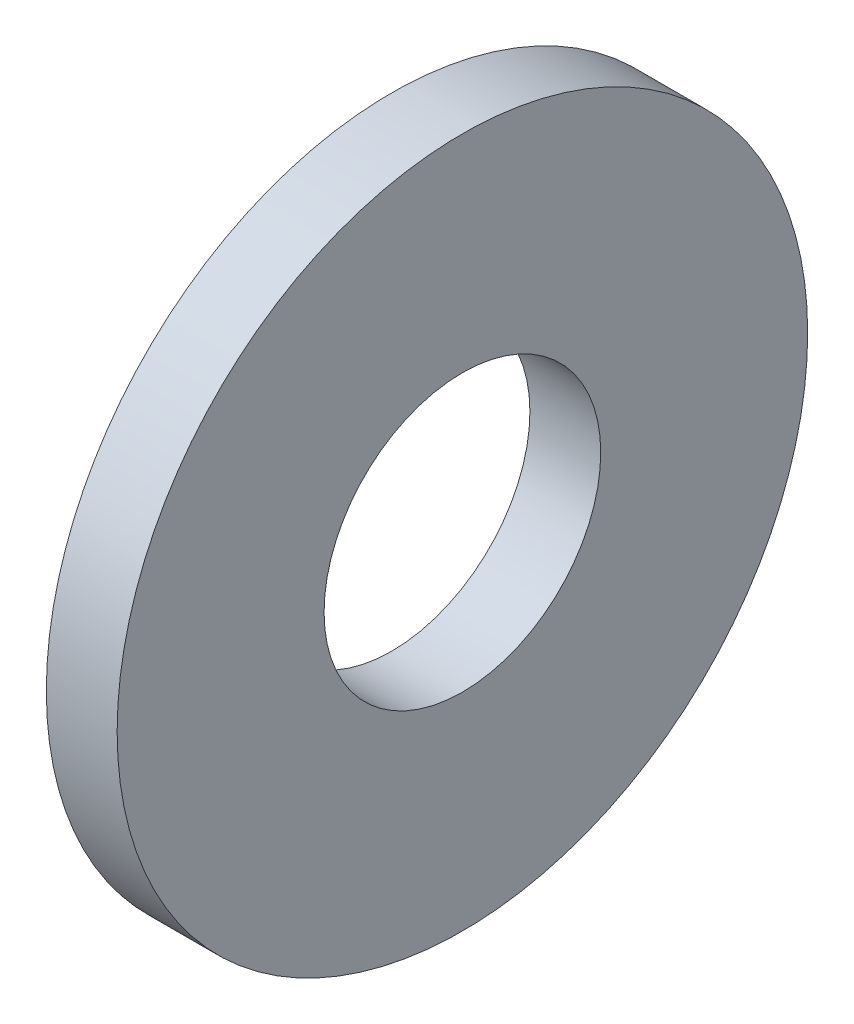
SolidWorks part; units mm, degrees
ref_plane "Plane1" through (0, 0, 0) normal (0, 0, 1) x (1, 0, 0)
ref_plane "Plane2" through (0, 0, 0) normal (0, 1, 0) x (1, 0, 0)
ref_plane "Plane3" through (0, 0, 0) normal (1, 0, 0) x (0, 0, -1)
revolve "Base-Revolve" add sketch "Sketch1" angle 360 about L0
sketch "Sketch1" plane through (0, 0, 0) normal (0, 0, 1) x (1, 0, 0)
  line L0 (-34.925, 0) -> (9.525, 0) construction
  line L1 (0, 1.5875) -> (0, 3.9624)
  line L2 (0, 3.9624) -> (-0.8128, 3.9624)
  line L3 (-0.8128, 3.9624) -> (-0.8128, 1.5875)
  line L4 (-0.8128, 1.5875) -> (0, 1.5875)
  dimension "Thickness" = 0.8128
  dimension "Inside_dia" = 3.175
  dimension "Outside_dia" = 7.9248
